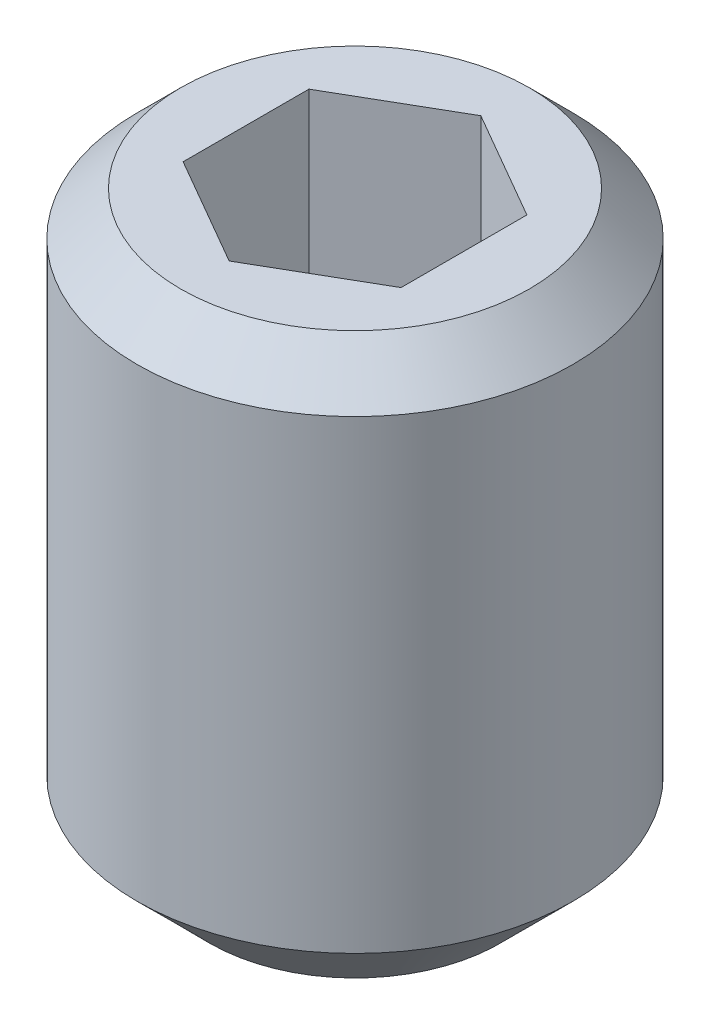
SolidWorks part; units mm, degrees
ref_plane "Face" through (0, 0, 0) normal (0, 0, 1) x (1, 0, 0)
ref_plane "Dessus" through (0, 0, 0) normal (0, 1, 0) x (1, 0, 0)
ref_plane "Droite" through (0, 0, 0) normal (1, 0, 0) x (0, 0, -1)
sketch "Esquisse1" plane through (0, 0, 0) normal (0, 0, 1) x (1, 0, 0)
  line L0 (0, -4) -> (0, 0) construction
  line L1 (0.75, 0) -> (1.2, 0)
  line L2 (1.2, 0) -> (1.5, -0.3)
  line L3 (0.75, 0) -> (0.75, -1.5)
  line L4 (0.75, -1.5) -> (0, -1.933)
  line L5 (1.5, -0.3) -> (1.5, -3.5)
  line L6 (0, -4) -> (0, -1.933)
  line L7 (-1.5, 0) -> (1.5, 0) construction
  line L9 (0, -4) -> (1, -4)
  line L10 (1, -4) -> (1.5, -3.5)
  line L11 (-1, 0) -> (1, 0) construction
  dimension "D2" = 45
  dimension "D4" = 0.75
  dimension "D1" = 1.5
  dimension "Diamètre nominal" = 3
  dimension "D3" = 0.3
  dimension "D5" = 120
  dimension "Cote sur plats" = 1.5
  dimension "D6" = 1
  dimension "D7" = 45
  dimension "Diamètre d1" = 2
  dimension "Longueur" = 4
revolve "Base-Révolution" add sketch "Esquisse1" angle 360 about L0
sketch "Esquisse2" plane through (0, 0, 0) normal (0, 1, 0) x (-1, 0, 0)
  line L0 (0, 0) -> (0.75, 0) construction
  line L1 (0, 0) -> (1.299, 0.75) construction
  line L2 (0, 0) -> (0.75, 1.299) construction
  line L3 (0, 0) -> (0, 1.5) construction
  line L4 (0.75, -0.433) -> (0.75, 0.433)
  line L5 (0.75, 0.433) -> (0, 0.866)
  line L6 (-0.75, 0.433) -> (0, 0.866)
  line L7 (-0.75, -0.433) -> (-0.75, 0.433)
  line L8 (0.75, -0.433) -> (0, -0.866)
  line L9 (-0.75, -0.433) -> (0, -0.866)
  circle A0 centre (0, 0) radius 0.75 construction
  circle A2 centre (0, 0) radius 1.5 construction
  point P17 (-0.75, 0)
  dimension "D1" = 30
  dimension "D2" = 30
extrude "Enlèv. mat.-Extru.1" cut sketch "Esquisse2" against normal blind 1.5
